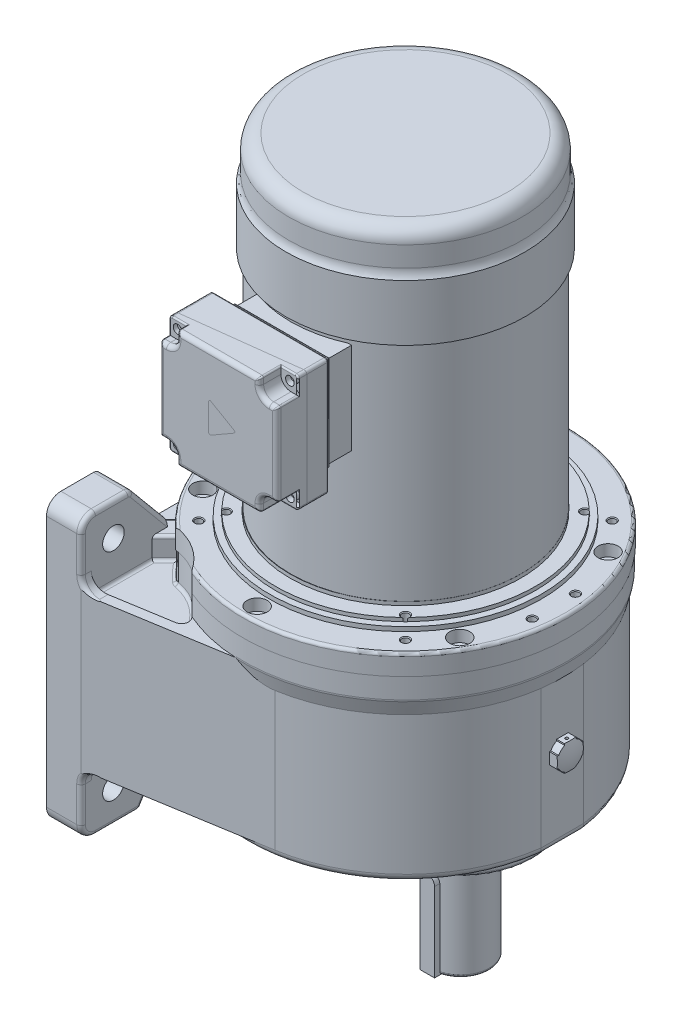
SolidWorks part; units mm, degrees
ref_plane "前视基准面" through (0, 0, 0) normal (0, 0, 1) x (1, 0, 0)
ref_plane "上视基准面" through (0, 0, 0) normal (0, 1, 0) x (1, 0, 0)
ref_plane "右视基准面" through (0, 0, 0) normal (1, 0, 0) x (0, 0, -1)
imported_body "接线盒座-1-surface1"
imported_body "接线盒座-1-surface2"
imported_body "接线盒座-1-surface3"
imported_body "接线盒座-1-surface4"
imported_body "接线盒座-1-surface5"
imported_body "接线盒座-1-surface6"
imported_body "接线盒座-1-surface7"
imported_body "接线盒座-1-surface8"
imported_body "接线盒盖-1-surface1"
imported_body "接线盒盖-1-surface2"
imported_body "接线盒盖-1-surface3"
imported_body "15.04.12 40卧式箱体D版-1-surface1"
imported_body "15.04.12 40卧式箱体D版-1-surface2"
imported_body "15.04.12 40卧式箱体D版-1-surface3"
imported_body "15.04.12 40卧式箱体D版-1-surface4"
imported_body "15.04.12 40卧式箱体D版-1-surface5"
imported_body "15.07.07 40箱盖(新)-1-surface1"
imported_body "15.07.07 40箱盖(新)-1-surface2"
imported_body "15.07.07 40箱盖(新)-1-surface3"
imported_body "透气塞-1-surface1"
sketch "草图1" plane through (0, -142.2215, 0) normal (0, 1, 0) x (1, 0, 0)
  circle A0 centre (-59.2668, 63.539) radius 80
  circle A1 centre (-21.2668, 63.539) radius 38 construction
extrude "凸台-拉伸1" add sketch "草图1" along normal blind 161
sketch "草图2" plane through (0, 18.7785, 0) normal (0, 1, 0) x (1, 0, 0)
  circle A0 centre (-59.4668, 63.539) radius 83
extrude "凸台-拉伸2" add sketch "草图2" along normal blind 39
sketch "草图3" plane through (0, 57.7785, 0) normal (0, 1, 0) x (1, 0, 0)
  circle A0 centre (-59.4668, 63.539) radius 81
extrude "凸台-拉伸3" add sketch "草图3" along normal blind 30
fillet "圆角1" radius 10 1 edges at (-59.4668, 87.7785, 17.461)
fillet "圆角2" radius 10 1 edges at (-59.4668, 57.7785, 17.461)
